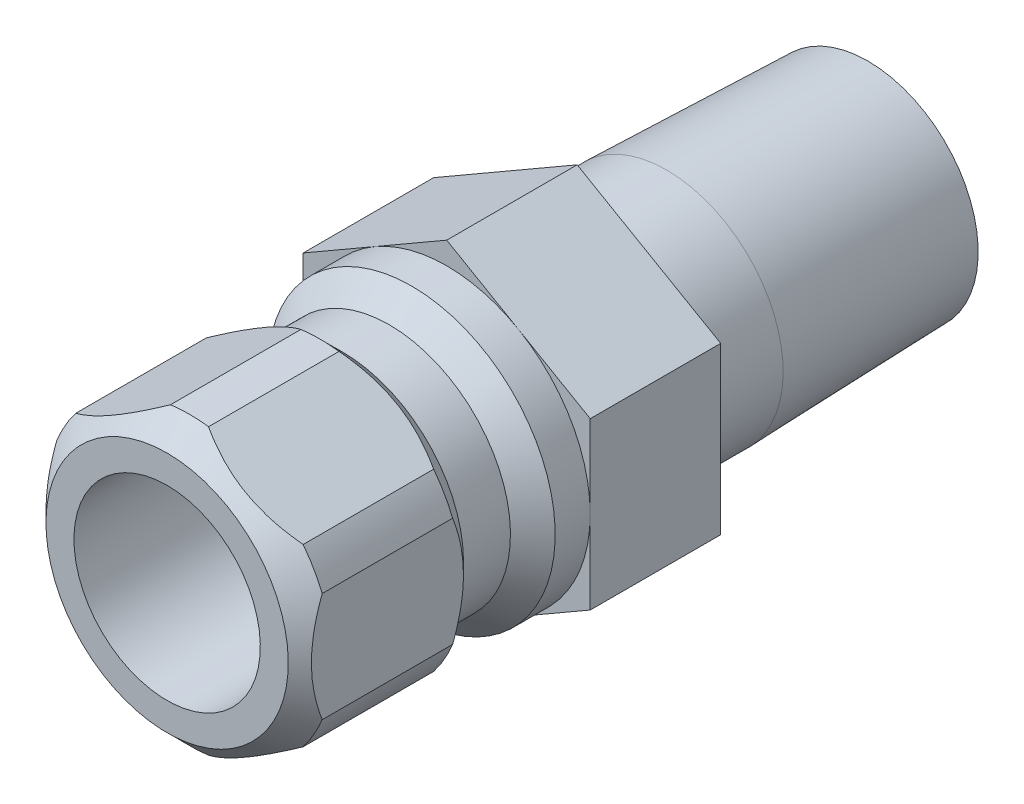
SolidWorks part; units mm, degrees
ref_plane "Front Plane" through (0, 0, 0) normal (0, 0, 1) x (1, 0, 0)
ref_plane "Top Plane" through (0, 0, 0) normal (0, 1, 0) x (1, 0, 0)
ref_plane "Right Plane" through (0, 0, 0) normal (1, 0, 0) x (0, 0, -1)
sketch "Sketch1" plane through (0, 0, 0) normal (1, 0, 0) x (0, 0, -1)
  line L0 (0, 0) -> (-12.7, 0) construction
  line L1 (-9.525, 3.175) -> (-9.525, 4.1275)
  line L2 (-3.556, 4.1275) -> (-3.556, 0) construction
  line L3 (-8.763, 4.8895) -> (-4.318, 4.8895)
  line L4 (0, 3.9688) -> (0, 0) construction
  line L5 (-3.556, 4.1275) -> (-1.9558, 4.1275)
  line L6 (-1.1938, 4.8895) -> (0, 4.8895)
  line L7 (0, 4.8895) -> (0, 3.9688)
  line L8 (-3.556, 4.1275) -> (-4.318, 4.8895)
  line L9 (-1.9558, 4.1275) -> (-1.1938, 4.8895)
  line L10 (-9.525, 4.1275) -> (-8.763, 4.8895)
  line L11 (0, 0) -> (4.445, 0) construction
  line L12 (0, 3.9688) -> (7.493, 3.9688)
  line L13 (7.493, 3.9688) -> (14.351, 3.7544)
  line L14 (14.351, 3.7544) -> (14.351, 2.3813)
  line L15 (0.127, 3.175) -> (-9.525, 3.175)
  line L16 (0.127, 3.175) -> (0.127, 2.3812)
  line L17 (0.127, 2.3812) -> (14.351, 2.3813)
  dimension "D1" = 9.525
  dimension "D2" = 1.6002
  dimension "D3" = 0.762
  dimension "D4" = 45
  dimension "D5" = 5.969
  dimension "D6" = 45
  dimension "D7" = 1.79
  dimension "D8" = 6.858
  dimension "D9" = 23.876
  dimension "D10" = 3.175
  dimension "D11" = 6.35
  dimension "D12" = 4.7625
  dimension "D13" = 4.445
  dimension "D14" = 9.779
  dimension "D15" = 7.9375
  dimension "D16" = 9.652
revolve "Revolve1" add sketch "Sketch1" angle 360 about L0
sketch "Sketch2" plane through (0, 0, 0) normal (0, 0, 1) x (1, 0, 0)
  line L1 (-4.8895, 2.823) -> (-4.8895, -2.823)
  line L2 (-4.8895, -2.823) -> (0, -5.6459)
  line L3 (0, -5.6459) -> (4.8895, -2.823)
  line L4 (4.8895, -2.823) -> (4.8895, 2.823)
  line L5 (4.8895, 2.823) -> (0, 5.6459)
  line L6 (0, 5.6459) -> (-4.8895, 2.823)
  circle A0 centre (0, 0) radius 4.8895 construction
  circle A2 centre (0, 0) radius 2.3812 construction
  circle A3 centre (0, 0) radius 2.3812
  dimension "D1" = 9.779
extrude "Boss-Extrude1" add sketch "Sketch2" against normal up to vertex (4.445 mm away)
sketch "Sketch3" plane through (0, 0, 0) normal (0, 0, 1) x (1, 0, 0)
  line L1 (-4.5212, 2.6103) -> (-4.5212, -2.6103)
  line L2 (-4.5212, -2.6103) -> (0, -5.2206)
  line L3 (0, -5.2206) -> (4.5212, -2.6103)
  line L4 (4.5212, -2.6103) -> (4.5212, 2.6103)
  line L5 (4.5212, 2.6103) -> (0, 5.2206)
  line L6 (0, 5.2206) -> (-4.5212, 2.6103)
  circle A0 centre (0, 0) radius 4.5212 construction
  dimension "D1" = 9.0424
extrude "Cut-Extrude1" cut sketch "Sketch3" along normal through all from vertex at 3.556 flip side to cut
